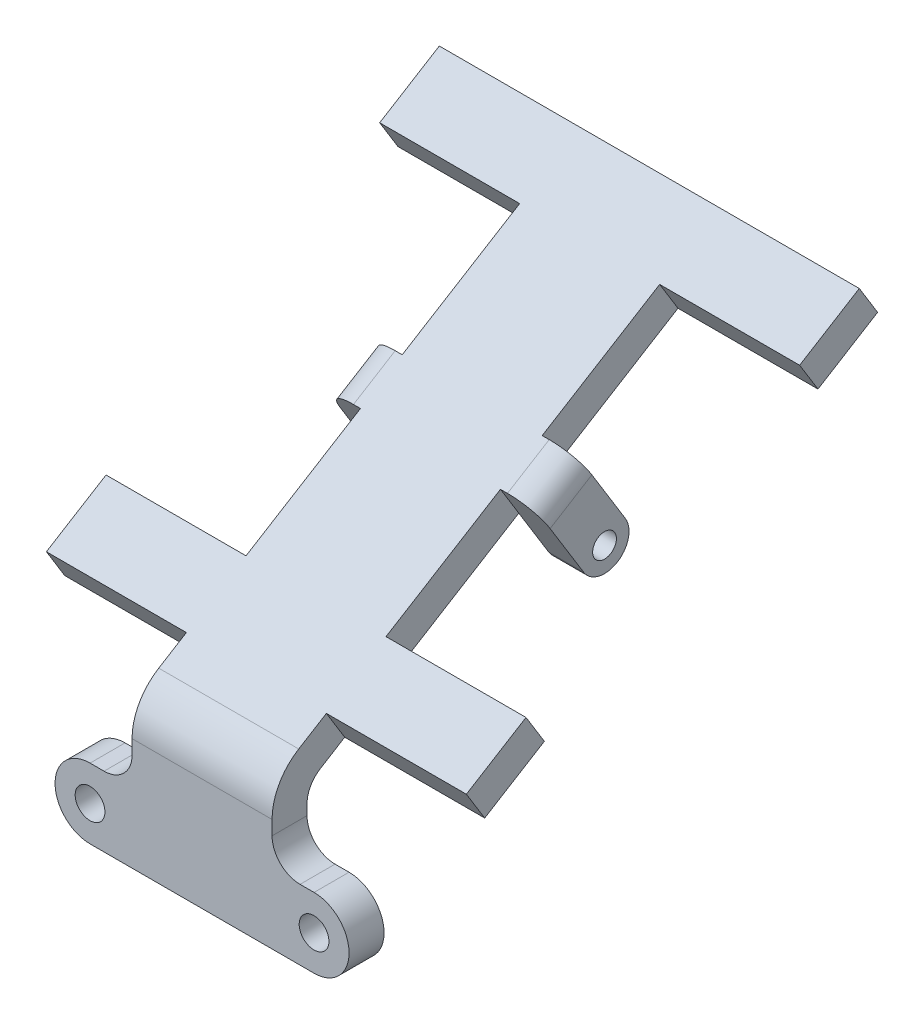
SolidWorks part; units mm, degrees
ref_plane "Face" through (0, 0, 0) normal (0, 0, 1) x (1, 0, 0)
ref_plane "Dessus" through (0, 0, 0) normal (0, 1, 0) x (1, 0, 0)
ref_plane "Droite" through (0, 0, 0) normal (1, 0, 0) x (0, 0, -1)
sketch "Esquisse1" plane through (0, 0, 0) normal (0, 0, 1) x (1, 0, 0)
  line L0 (0, 58.6242) -> (0, 126.4014) construction
  line L1 (0, 17.6) -> (0, 0) construction
  line L2 (-20, 86.6242) -> (-20, 99.6242)
  line L3 (-32, 58.6242) -> (-26.5, 58.6242)
  line L4 (-26.5, 58.6242) -> (-26.5, 78.6242)
  line L5 (-26.5, 78.6242) -> (-32, 78.6242)
  line L6 (-32, 58.6242) -> (26.5, 58.6242)
  line L7 (20, 86.6242) -> (20, 99.6242)
  line L8 (20, 99.6242) -> (-20, 99.6242)
  line L9 (32, 78.6242) -> (26.5, 78.6242)
  line L10 (26.5, 78.6242) -> (26.5, 58.6242)
  line L11 (26.5, 58.6242) -> (32, 58.6242)
  line L12 (32, 78.6242) -> (28, 78.6242)
  line L13 (-28, 78.6242) -> (-32, 78.6242)
  line L14 (26.5, 58.6242) -> (32, 58.6242)
  circle A0 centre (-32, 68.6242) radius 4.25
  arc A1 (-32, 78.6242) -> (-32, 58.6242) centre (-32, 68.6242) ccw
  arc A2 (-32, 78.6242) -> (-32, 58.6242) centre (-32, 68.6242) ccw
  arc A3 (32, 58.6242) -> (32, 78.6242) centre (32, 68.6242) ccw
  arc A4 (32, 58.6242) -> (32, 78.6242) centre (32, 68.6242) ccw
  circle A5 centre (32, 68.6242) radius 4.25
  circle A9 centre (32, 68.6242) radius 4.25 construction
  circle A10 centre (-32, 68.6242) radius 4.25 construction
  arc A11 (28, 78.6242) -> (20, 86.6242) centre (28, 86.6242) cw
  arc A12 (-28, 78.6242) -> (-20, 86.6242) centre (-28, 86.6242) ccw
  point P27 (20, 78.6242)
  point P30 (-20, 78.6242)
  dimension "D5" = 8
  dimension "D3" = 21
  dimension "D4" = 20
  dimension "D1" = 0
  dimension "D2" = 0
extrude "Base-Extrusion" add sketch "Esquisse1" along normal blind 10
sketch "Esquisse2" plane through (0, 0, 0) normal (1, 0, 0) x (0, 0, -1)
  line L0 (-4.7633, 91.105) -> (123.0248, 169.6556)
  line L2 (-10, 99.6242) -> (117.7881, 178.1748)
  line L3 (-10, 99.6242) -> (-10, 86.6242) construction
  line L4 (-10, 99.6242) -> (-4.7633, 91.105)
  line L5 (123.0248, 169.6556) -> (117.7881, 178.1748)
  dimension "D1" = 10
  dimension "D2" = 150
extrude "Boss.-Extru.1" add sketch "Esquisse2" along normal mid plane 40
fillet "Congé1" radius 8
fillet "Congé2" radius 16
sketch "Esquisse3" plane through (-20, 10.479, -73.5473) normal (-1, 0, 0) x (0, 0, 1)
  line L0 (4.5107, 106.8553) -> (18.284, 129.2621)
  line L2 (-7.4162, 114.1867) -> (6.3572, 136.5935)
  line L4 (18.284, 129.2621) -> (6.3572, 136.5935)
  line L5 (-44.2408, 167.6958) -> (75.926, 93.8299) construction
  arc A0 (-7.4162, 114.1867) -> (4.5107, 106.8553) centre (-1.4527, 110.521) ccw
  circle A1 centre (-1.4527, 110.521) radius 3.4
  circle A2 centre (-1.4527, 110.521) radius 3.4 construction
  arc A3 (37.07, 89.521) -> (-39.9755, 89.521) centre (-1.4527, 43.521) ccw construction
extrude "Boss.-Extru.2" add sketch "Esquisse3" along normal blind 10
mirror "Symétrie1" about plane through (0, 0, 0) normal (1, 0, 0)
fillet "Congé4" radius 8
sketch "Esquisse4" plane through (0, 76.7654, 47.1872) normal (0, 0.8519, 0.5237) x (-1, 0, 0)
  line L0 (-20, -193.6511) -> (20, -193.6511) construction
  line L1 (-60, -61.8718) -> (60, -61.8718)
  line L2 (-60, -61.8718) -> (-60, -81.8718)
  line L3 (-60, -81.8718) -> (60, -81.8718)
  line L4 (60, -61.8718) -> (60, -81.8718)
  line L5 (-60, -173.6511) -> (60, -173.6511)
  line L6 (-60, -173.6511) -> (-60, -193.6511)
  line L7 (-60, -193.6511) -> (60, -193.6511)
  line L8 (60, -173.6511) -> (60, -193.6511)
  line L9 (20, -193.6511) -> (20, -134.2582) construction
  dimension "D1" = 20
  dimension "D2" = 20
  dimension "D3" = 120
  dimension "D4" = 40
extrude "Boss.-Extru.3" add sketch "Esquisse4" against normal up to surface (10 mm away)
